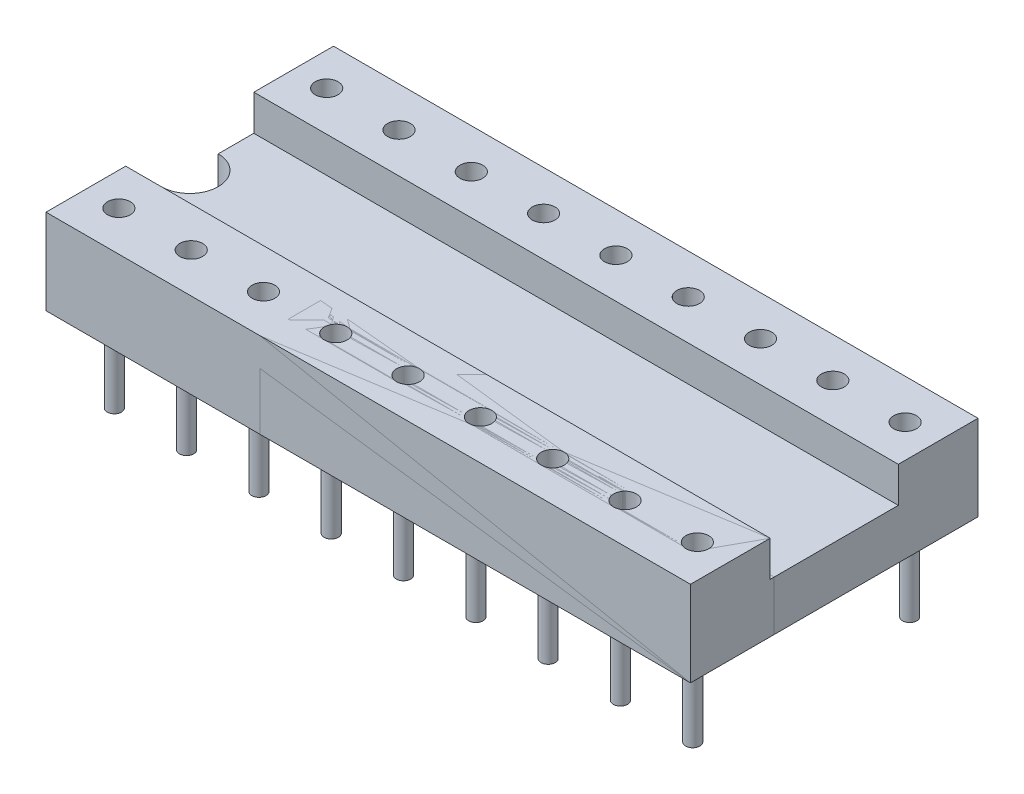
SolidWorks part; units mm, degrees
ref_plane "Plan de face" through (0, 0, 0) normal (0, 0, 1) x (1, 0, 0)
ref_plane "Plan de dessus" through (0, 0, 0) normal (0, 1, 0) x (1, 0, 0)
ref_plane "Plan de droite" through (0, 0, 0) normal (1, 0, 0) x (0, 0, -1)
imported_body "Importée1"
sketch "Esquisse1" plane through (0, 3, 0) normal (0, 1, 0) x (-1, 0, 0)
  line L1 (-23.6517, 2.1099) -> (0.5781, 2.1099)
  line L2 (-23.6517, 2.1099) -> (-23.6517, -5.6178)
  line L3 (-23.6517, -5.6178) -> (0.5781, -5.6178)
  line L4 (0.5781, 2.1099) -> (0.5781, -5.6178)
extrude "Enlèv. mat.-Extru.1" cut sketch "Esquisse1" against normal through all
sketch "Esquisse2" plane through (0, 3, 0) normal (0, 1, 0) x (-1, 0, 0)
  line L1 (-7.51, 6.6368) -> (0.6116, 6.6368)
  line L2 (-7.51, 6.6368) -> (-7.51, 0.6121)
  line L3 (-7.51, 0.6121) -> (0.6116, 0.6121)
  line L4 (0.6116, 6.6368) -> (0.6116, 0.6121)
  circle A0 centre (-8.78, 3.65) radius 0.4 construction
  dimension "D1" = 1.27
extrude "Enlèv. mat.-Extru.2" cut sketch "Esquisse2" against normal through all
